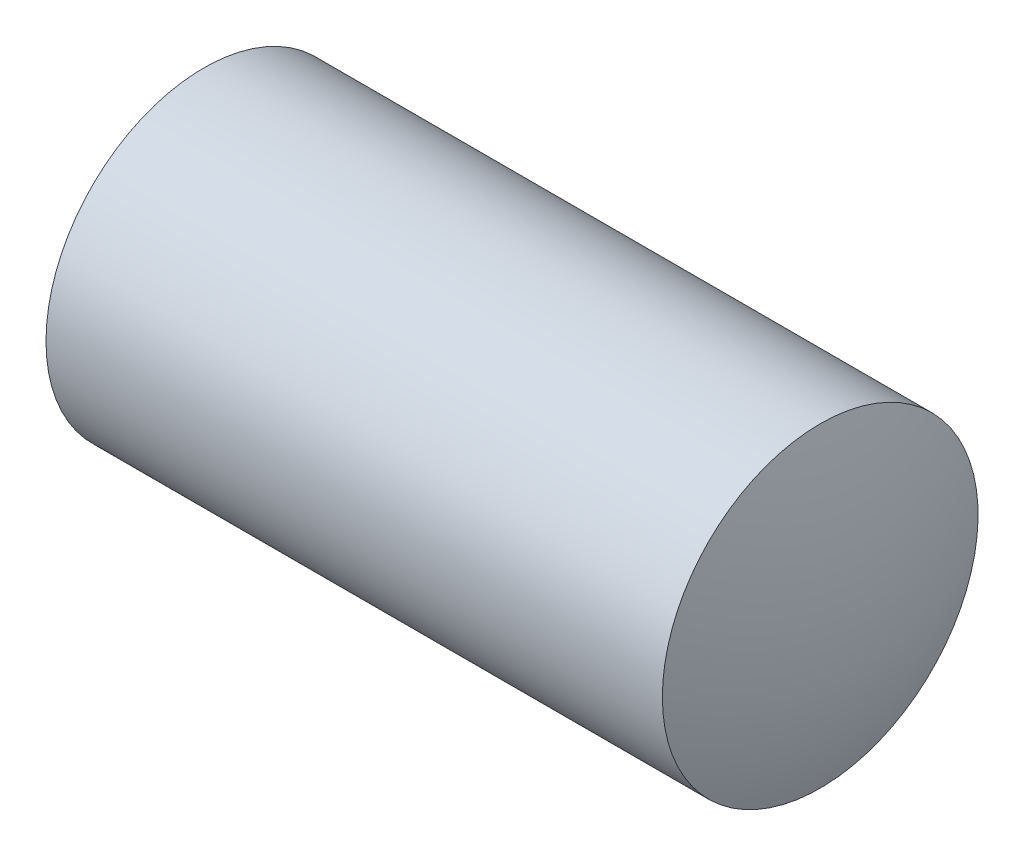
SolidWorks part; units mm, degrees
ref_plane "Plane1" through (0, 0, 0) normal (0, 0, 1) x (1, 0, 0)
ref_plane "Plane2" through (0, 0, 0) normal (0, 1, 0) x (1, 0, 0)
ref_plane "Plane3" through (0, 0, 0) normal (1, 0, 0) x (0, 0, -1)
sketch "BodySke" plane through (0, 0, 0) normal (0, 0, 1) x (1, 0, 0)
  line L0 (0, 0) -> (0, 10.352)
  line L1 (0, 10.352) -> (0.9515, 12)
  line L2 (0.9515, 12) -> (47.8119, 12)
  line L3 (48.3857, 15.875) -> (48.3857, -3.175) construction
  line L4 (50, 0) -> (0, 0)
  line L5 (-12.7, 0) -> (88.9, 0) construction
  line L8 (0, -10.352) -> (0.9515, -12) construction
  line L9 (3, 15.875) -> (3, -3.175) construction
  arc A0 (50, 0) -> (47.8119, 12) centre (16, 0) ccw
  dimension "Oval_rad" = 34
  dimension "Length" = 50
  dimension "Diameter" = 24
  dimension "Drive_ch_ang" = 60
  dimension "Minor_dia" = 20.704
  dimension "Advance" = 3
  dimension "Thread_len" = 47.4343
revolve "BaseBody" add sketch "BodySke" angle 360 about L5
sketch "Sketch2" plane through (0, 0, 0) normal (-1, 0, 0) x (0, 0, 1)
  line L0 (3.4641, 6) -> (-3.4641, 6)
  line L1 (-3.4641, 6) -> (-6.9282, 0)
  line L2 (3.4641, 6) -> (6.9282, 0)
  line L3 (3.4641, -6) -> (6.9282, 0)
  line L4 (3.4641, -6) -> (-3.4641, -6)
  line L5 (-3.4641, -6) -> (-6.9282, 0)
  dimension "Hex_size" = 12
  dimension "D2" = 6
  dimension "D3" = 6
extrude "Hex" cut sketch "Sketch2" against normal blind 15
sketch "ThdSchSke" plane through (0, 0, 0) normal (0, 0, 1) x (1, 0, 0)
  line L0 (0.9515, -10.352) -> (-0.2025, -12)
  line L1 (0.9515, -10.352) -> (2.1054, -12)
  line L2 (2.1054, -12) -> (2.1054, -15)
  line L3 (-3.175, 0) -> (5.1513, 0) construction
  line L5 (2.1054, -15) -> (-0.2025, -15)
  line L6 (-0.2025, -15) -> (-0.2025, -12)
  line L8 (0.9515, 12) -> (0.9515, -12) construction
  dimension "Thread_minor" = 20.704
  dimension "Diameter" = 24
  dimension "SideAngle" = 55
  dimension "VeeAngle" = 70
  dimension "Overcut" = 30
revolve "ThreadSchematic" [suppressed] cut sketch "ThdSchSke" angle 360 about L3
pattern_linear "ThdSchPat" [suppressed]
equation "\"D2@Sketch2\" = \"Hex_size@Sketch2\" / 2"
equation "\"D3@Sketch2\" = \"Hex_size@Sketch2\" / 2"
equation "\"Thread_minor@ThreadCosmetic\" = \"Minor_dia@BodySke\""
equation "\"Thread_minor@ThdSchSke\" = \"Thread_minor@ThreadCosmetic\""
equation "\"Diameter@ThdSchSke\" = \"Diameter@BodySke\""
equation "\"Overcut@ThdSchSke\" = \"Diameter@BodySke\" * 1.25"
equation "\"Thread_len@BodySke\" = \"Length@BodySke\" -  ( ( ( \"Diameter@BodySke\" - \"Minor_dia@BodySke\" ) * 0.5 ) / tan( \"Drive_ch_ang@BodySke\" * 0.017453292 ) )"
equation "\"Thread_len@BodySke\" = \"Thread_len@BodySke\" - \"Oval_rad@BodySke\" + sqr(\"Oval_rad@BodySke\" * \"Oval_rad@BodySke\" - (\"Minor_dia@BodySke\" / 2) * (\"Minor_dia@BodySke\" / 2))"
equation "\"Num_threads@ThdSchPat\" = int( \"Thread_len@BodySke\" / \"Advance@BodySke\" + 0.999 )  + 1"
equation "\"Advance@ThdSchPat\" = \"Thread_len@BodySke\" /  (\"Num_threads@ThdSchPat\" - 1) 'relax it"
